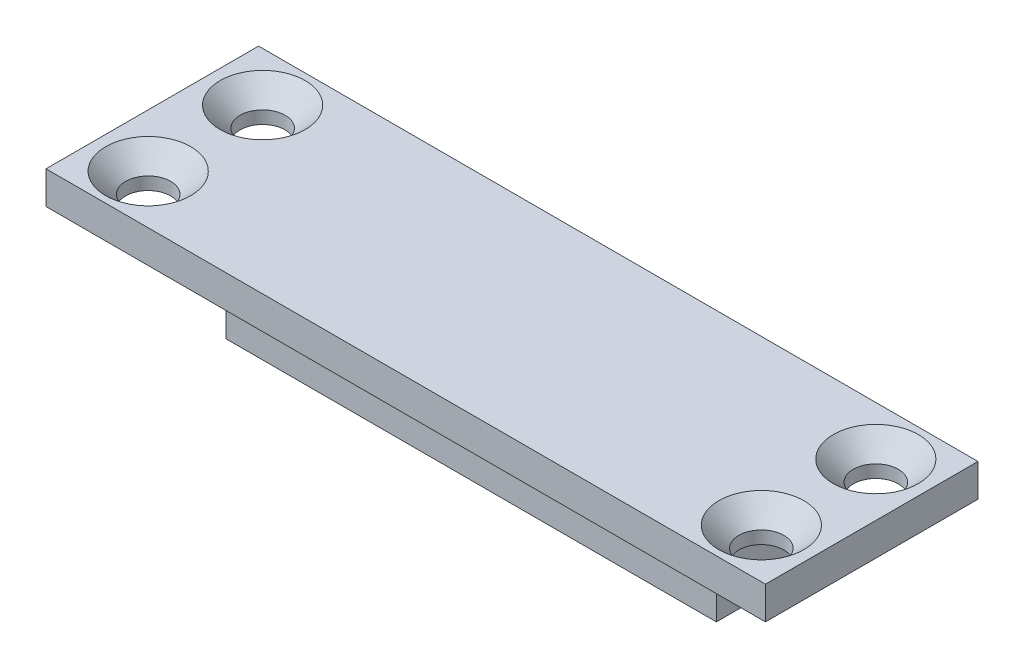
SolidWorks part; units mm, degrees
ref_plane "Спереди" through (0, 0, 0) normal (0, 0, 1) x (1, 0, 0)
ref_plane "Сверху" through (0, 0, 0) normal (0, 1, 0) x (1, 0, 0)
ref_plane "Справа" through (0, 0, 0) normal (1, 0, 0) x (0, 0, -1)
sketch "Эскиз1" plane through (0, 0, 0) normal (1, 0, 0) x (0, 0, -1)
  line L0 (5, -4) -> (13, -4)
  line L1 (-13, 0) -> (13, 0)
  line L2 (13, 0) -> (13, -4)
  line L3 (-13, -4) -> (-5, -4)
  line L4 (-13, 0) -> (-13, -4)
  line L6 (-5, -4) -> (-5, -15)
  line L7 (-5, -15) -> (5, -15)
  line L8 (5, -4) -> (5, -15)
  circle A2 centre (0, -2.7) radius 13.2774 construction
  dimension "D6" = 26.5548
  dimension "D1" = 10
  dimension "D2" = 11
  dimension "D3" = 4
  dimension "D4" = 26
extrude "Бобышка-Вытянуть1" add sketch "Эскиз1" along normal blind 88
sketch "Эскиз2" plane through (0, 0, 0) normal (0, 0, 1) x (1, 0, 0)
  line L0 (88, -15) -> (0, -15) construction
  line L1 (0, -4) -> (14, -4)
  line L2 (0, -4) -> (0, -15)
  line L3 (0, -15) -> (14, -15)
  line L4 (14, -4) -> (14, -15)
  line L5 (14, -4) -> (74, -4) construction
  line L6 (88, -4) -> (74, -4)
  line L7 (88, -4) -> (88, -15)
  line L8 (88, -15) -> (74, -15)
  line L9 (74, -4) -> (74, -15)
  point P4 (44, -4)
  dimension "D1" = 60
extrude "Вырез-Вытянуть1" cut sketch "Эскиз2" against normal mid plane 67
hole_wizard "Зенковка для винта с полупотайной головкой M51" positions "Эскиз4" profile "Эскиз3" countersink size "M5" standard "ГОСТ"
sketch "Эскиз4" plane through (0, 0, 0) normal (0, 1, 0) x (-1, 0, 0)
  line L5 (-6.5, -7) -> (-81.5, -7) construction
  line L6 (-6.5, -7) -> (-6.5, 7) construction
  line L7 (-6.5, 7) -> (-81.5, 7) construction
  line L8 (-81.5, -7) -> (-81.5, 7) construction
  line L9 (-6.5, -7) -> (-81.5, 7) construction
  line L10 (-6.5, 7) -> (-81.5, -7) construction
  point P181 (-6.5, 7)
  point P183 (-6.5, -7)
  point P185 (-81.5, -7)
  point P187 (-81.5, 7)
  dimension "D1" = 75
  dimension "D2" = 14
sketch "Эскиз3" plane through (6.5, 0, 7) normal (1, 0, 0) x (0, 0, 1)
  line L0 (0, 0) -> (0, 15)
  line L1 (0, 15) -> (2.75, 15)
  line L2 (2.75, 15) -> (2.75, 2.45)
  line L3 (2.75, 2.45) -> (5.2, 0)
  line L5 (5.2, 0) -> (0, 0)
  line L6 (-2.75, 2.45) -> (-5.2, 0) construction
  line L11 (0, -6.35) -> (0, 107.95) construction
  dimension "Диаметр сквозного отверстия" = 5.5
  dimension "Глубина сквозного отверстия" = 15
  dimension "Диаметр передней зенковки" = 10.4
  dimension "Угол передней зенковки" = 90
hole_wizard "CSK for M5 Countersunk Head Screw 174751" positions "Эскиз6" profile "Эскиз5" countersink size "M5" standard "GOST"
sketch "Эскиз6" plane through (0, 0, 0) normal (0, 1, 0) x (1, 0, 0)
  line L0 (62.5, 0) -> (5.5, 0) construction
  point P0 (62.5, 0)
  point P2 (5.5, 0)
  dimension "D1" = 57
sketch "Эскиз5" plane through (62.5, 0, 0) normal (1, 0, 0) x (0, 0, 1)
  line L0 (0, 0) -> (0, 13.5)
  line L1 (0, 13.5) -> (2.75, 13.5)
  line L2 (2.75, 13.5) -> (2.75, 2.45)
  line L3 (2.75, 2.45) -> (5.2, 0)
  line L5 (5.2, 0) -> (0, 0)
  line L6 (-2.75, 2.45) -> (-5.2, 0) construction
  line L11 (0, -6.35) -> (0, 107.95) construction
  dimension "Диаметр сквозного отверстия" = 5.5
  dimension "Глубина сквозного отверстия" = 13.5
  dimension "Диаметр передней зенковки" = 10.4
  dimension "Угол передней зенковки" = 90
